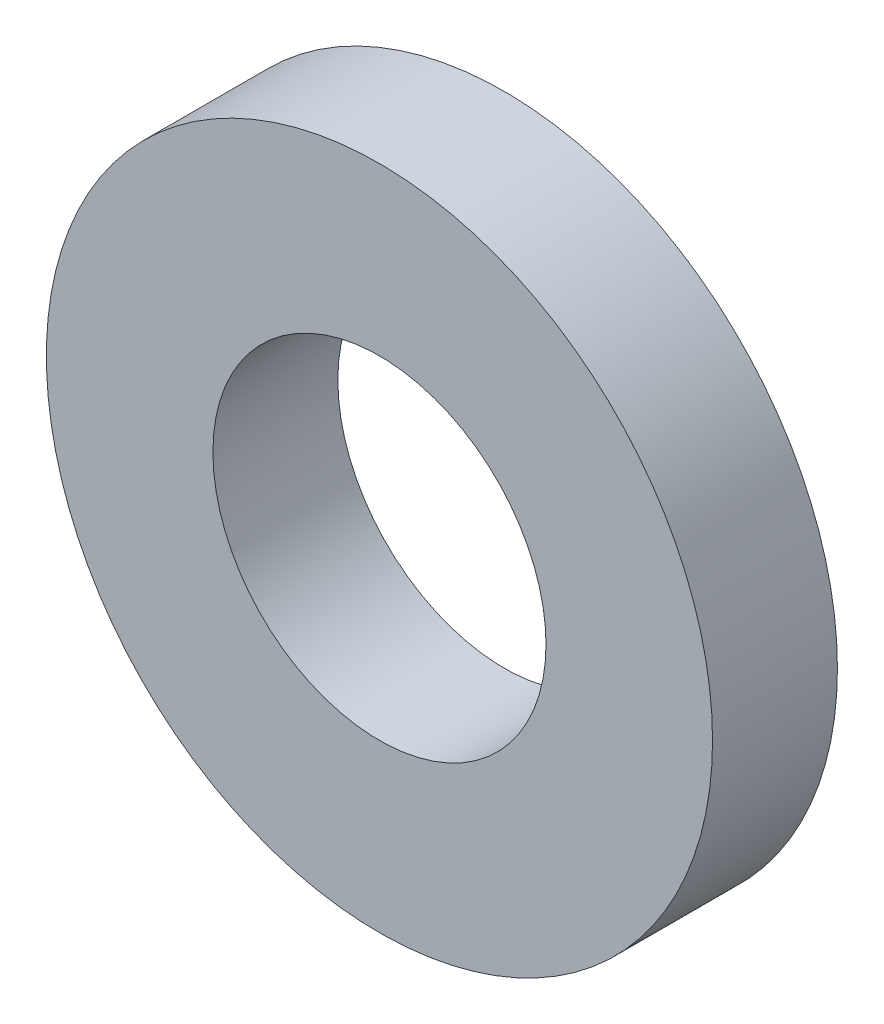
SolidWorks part; units mm, degrees
ref_plane "Plan de face" through (0, 0, 0) normal (0, 0, 1) x (1, 0, 0)
ref_plane "Plan de dessus" through (0, 0, 0) normal (0, 1, 0) x (1, 0, 0)
ref_plane "Plan de droite" through (0, 0, 0) normal (1, 0, 0) x (0, 0, -1)
sketch "Esquisse1" plane through (0, 0, 0) normal (0, 0, 1) x (1, 0, 0)
  circle A0 centre (39, 44) radius 4
  circle A1 centre (39, 44) radius 2
  dimension "D1" = 8
extrude "Boss.-Extru.1" add sketch "Esquisse1" against normal blind 1.5
